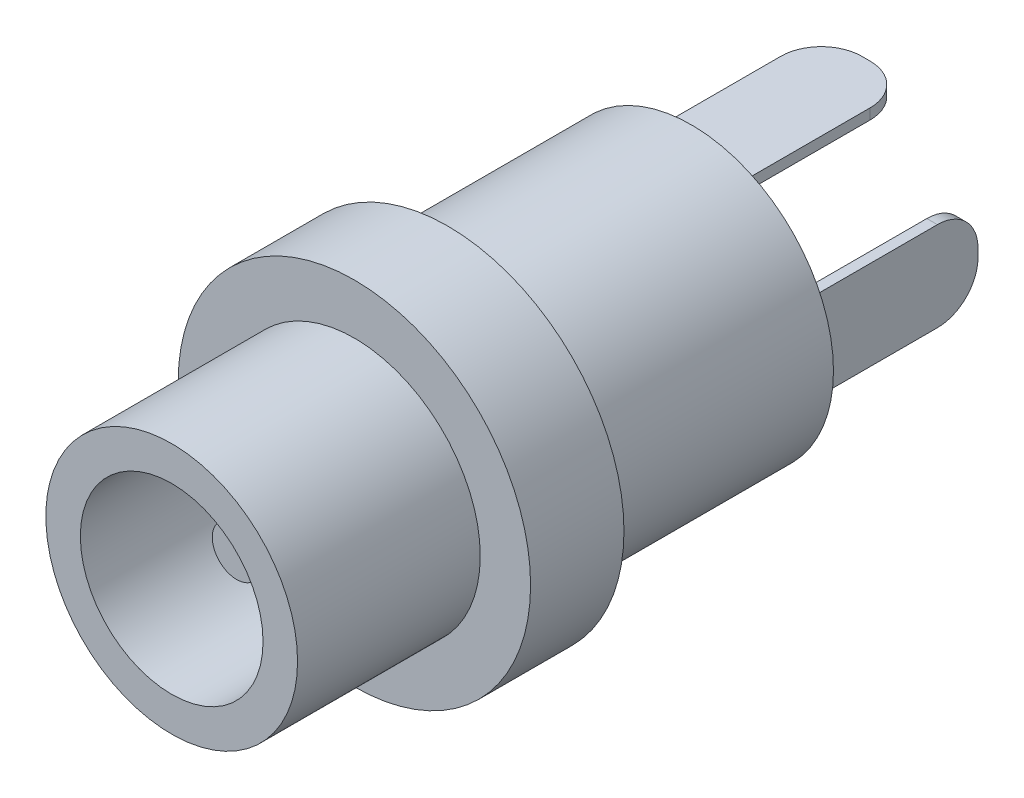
SolidWorks part; units mm, degrees
ref_plane "Front" through (0, 0, 0) normal (0, 0, 1) x (1, 0, 0)
ref_plane "Top" through (0, 0, 0) normal (0, 1, 0) x (1, 0, 0)
ref_plane "Right" through (0, 0, 0) normal (1, 0, 0) x (0, 0, -1)
sketch "Sketch1"
  dimension "D1" = 11.0236
extrude "Extrude1" add sketch "Sketch1" along normal blind 2.921
sketch "Sketch2"
  dimension "D1" = 7.874
extrude "Extrude2" add sketch "Sketch2" along normal blind 5.715
sketch "Sketch3"
  dimension "D1" = 8.89
extrude "Extrude3" add sketch "Sketch3" along normal blind 7.62
sketch "Sketch4"
  dimension "D1" = 2.794
  dimension "D2" = 2.794
  dimension "D3" = 2.794
  dimension "D4" = 0.3302
  dimension "D5" = 0.3302
  dimension "D6" = 0.3302
  dimension "D7" = 3.175
  dimension "D8" = 3.175
  dimension "D9" = 3.175
extrude "Extrude4" add sketch "Sketch4" along normal blind 5.461
fillet "Fillet1" radius 1.27 6 edges at (1.397, 3.3401, -13.081) (-1.397, 3.3401, -13.081) (-3.3401, 1.397, -13.081) (-3.3401, -1.397, -13.081) (3.3401, -1.397, -13.081) (3.3401, 1.397, -13.081)
sketch "Sketch5"
  dimension "D1" = 5.715
extrude "Cut-Extrude1" cut sketch "Sketch5" against normal blind 5.461
sketch "Sketch6"
  dimension "D1" = 1.524
extrude "Extrude5" add sketch "Sketch6" along normal blind 3.429
